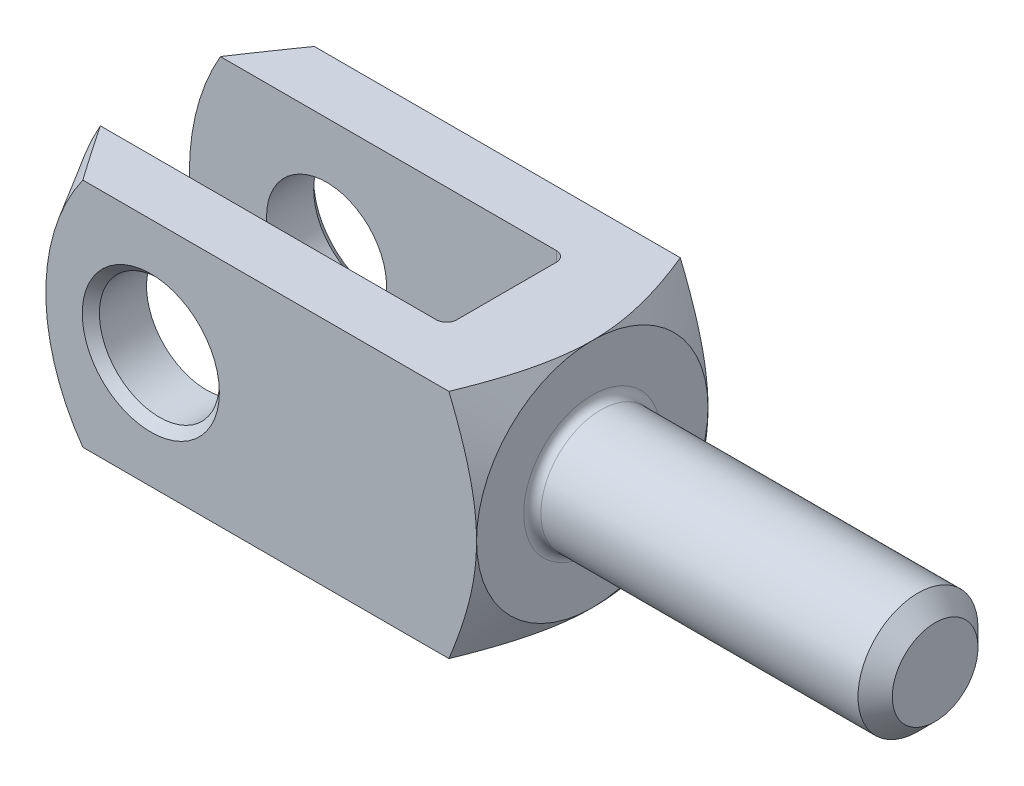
SolidWorks part; units mm, degrees
ref_plane "Front Plane" through (0, 0, 0) normal (0, 0, 1) x (1, 0, 0)
ref_plane "Top Plane" through (0, 0, 0) normal (0, 1, 0) x (1, 0, 0)
ref_plane "Right Plane" through (0, 0, 0) normal (1, 0, 0) x (0, 0, -1)
sketch "Sketch1" plane through (0, 0, 0) normal (1, 0, 0) x (0, 0, -1)
  line L0 (0, 0) -> (0, 50000) construction
  line L1 (0, 0) -> (50000, 0) construction
  line L2 (-13.5, -13.5) -> (-13.5, 13.5)
  line L3 (-13.5, 13.5) -> (13.5, 13.5)
  line L4 (13.5, -13.5) -> (13.5, 13.5)
  line L5 (-13.5, -13.5) -> (13.5, -13.5)
  point P9 (0, 13.5)
  point P11 (13.5, 0)
  point P12 (-13.5, 0)
  dimension "D1" = 27
  dimension "D2" = 27
extrude "Extrude1" add sketch "Sketch1" against normal blind 94
sketch "Sketch2" plane through (0, 0, 0) normal (1, 0, 0) x (0, 0, -1)
  circle A0 centre (0, 0) radius 7
  circle A1 centre (0, 0) radius 27
  dimension "D1" = 14
  dimension "D2" = 54
extrude "Extrude2" cut sketch "Sketch2" against normal blind 40
sketch "Sketch3" plane through (0, 0, 13.5) normal (0, 0, 1) x (1, 0, 0)
  circle A0 centre (-78, 0) radius 7
  dimension "D1" = 14
  dimension "D2" = 78
extrude "Extrude3" cut sketch "Sketch3" against normal through all
sketch "Sketch4" plane through (0, 13.5, 0) normal (0, 1, 0) x (1, 0, 0)
  line L0 (0, 0) -> (-50000, 0) construction
  line L1 (-94, -7) -> (-94, 7)
  line L2 (-94, 13.5) -> (-94, -13.5) construction
  line L3 (-94, 7) -> (-50, 7)
  line L4 (-50, 7) -> (-50, -7)
  line L5 (-78, 13.5) -> (-78, -13.5) construction
  line L6 (-94, -7) -> (-50, -7)
  point P7 (-78, 0)
  point P13 (-50, 0)
  point P14 (-94, 0)
  dimension "D1" = 28
  dimension "D2" = 14
extrude "Extrude4" cut sketch "Sketch4" against normal through all
fillet "Fillet1" radius 1.2 2 edges at (-50, 0, 7) (-50, 0, -7)
fillet "Fillet2" radius 1 1 edges at (-40, 0, -7)
chamfer "Chamfer2" distance 1 angle 45 2 edges at (-71, 0, -13.5) (-71, 0, 13.5)
sketch "Sketch6" plane through (0, 0, 0) normal (0, 0, 1) x (1, 0, 0)
  line L0 (-40, -13.5) -> (-40, -27)
  line L1 (-40, -27) -> (-47.7942, -27)
  line L2 (-47.7942, -27) -> (-40, -13.5)
  dimension "D1" = 30
  dimension "D2" = 27
revolve "Cut-Revolve1" cut sketch "Sketch6" angle 360 about axis through (-40, 0, 0) along (1, 0, 0)
sketch "Sketch7" plane through (0, 0, 0) normal (0, 1, 0) x (1, 0, 0)
  line L0 (-90.2472, -13.5) -> (-94, -7)
  line L1 (-94, 7) -> (-90.2472, 13.5)
  line L2 (-90.2472, 13.5) -> (-121, 13.5)
  line L3 (-94, 7) -> (-94, -7)
  line L4 (-121, 13.5) -> (-121, -13.5)
  line L5 (-121, -13.5) -> (-90.2472, -13.5)
  line L6 (-94, 13.5) -> (-43.2285, 13.5) construction
  line L7 (-94, -13.5) -> (-43.2285, -13.5) construction
  line L8 (-67, 0.6162) -> (-67, 50000.6162) construction
  dimension "D1" = 120
  dimension "D2" = 27
  dimension "D3" = 27
revolve "Cut-Revolve2" cut sketch "Sketch7" angle 180 about L8
chamfer "Chamfer3" distance 2 angle 45 1 edges at (0, 0, -7)
equation "\"D2@Sketch1\" = \"D1@Sketch1\""
equation "\"D2@Sketch2\" = \"D1@Sketch1\"/.5"
equation "\"D2@Sketch6\" = \"D1@Sketch1\""
equation "\"D2@Sketch7\" = \"D1@Sketch1\""
equation "\"D3@Sketch7\" = \"D1@Sketch1\""
